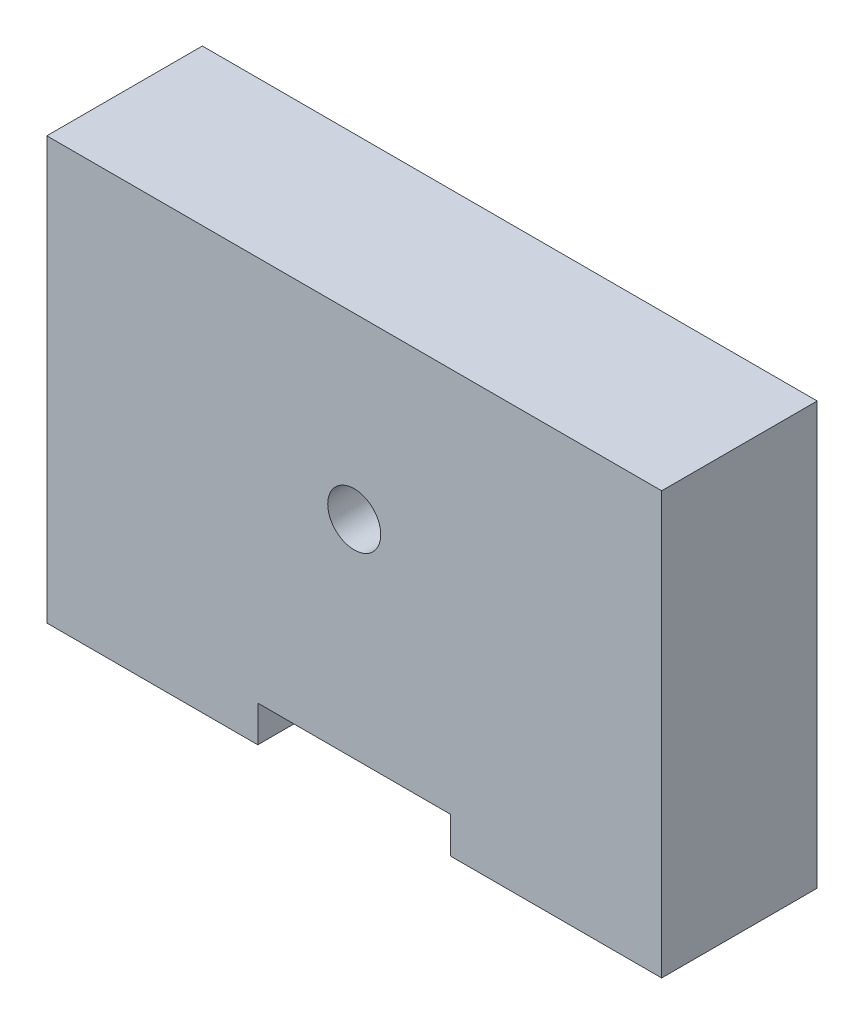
SolidWorks part; units mm, degrees
ref_plane "Front Plane" through (0, 0, 0) normal (0, 0, 1) x (1, 0, 0)
ref_plane "Top Plane" through (0, 0, 0) normal (0, 1, 0) x (1, 0, 0)
ref_plane "Right Plane" through (0, 0, 0) normal (1, 0, 0) x (0, 0, -1)
sketch "Sketch2" plane through (0, 0, 0) normal (0, 1, 0) x (1, 0, 0)
  line L0 (25.5, 6.45) -> (-25.5, 6.45)
  line L1 (25.5, 6.45) -> (25.5, -6.45)
  line L2 (25.5, -6.45) -> (-25.5, -6.45)
  line L3 (-25.5, 6.45) -> (-25.5, -6.45)
  line L4 (-18.75, 0) -> (18.75, 0) construction
  point P0 (-18.75, 0)
  point P1 (18.75, 0)
  point P6 (-25.5, 0)
  point P9 (0, 0)
  point P13 (0, 6.45)
  dimension "D1" = 37.5
  dimension "D2" = 12.9
  dimension "D3" = 51
extrude "Boss-Extrude1" add sketch "Sketch2" along normal blind 35
hole_wizard "M5x0.8 Tapped Hole1" positions "Sketch3" profile "Sketch4" tap size "M5x0.8" standard "ANSI Metric"
sketch "Sketch3" plane through (0, 0, 0) normal (0, -1, 0) x (-1, 0, 0)
  point P0 (-18.75, 0)
  point P3 (18.75, 0)
sketch "Sketch4" plane through (18.75, 0, 0) normal (1, 0, 0) x (0, 0, -1)
  line L0 (0, 0) -> (0, 13.6618)
  line L1 (0, 13.6618) -> (2.1, 12.4)
  line L2 (2.1, 12.4) -> (2.1, 0)
  line L5 (2.1, 0) -> (0, 0)
  line L10 (0, 13.6618) -> (-2.1, 12.4) construction
  line L11 (0, -6.35) -> (0, 107.95) construction
  dimension "Tap Drill Dia." = 4.2
  dimension "Tap Drill Depth" = 12.4
  dimension "Drill Angle" = 118
sketch "Sketch5" plane through (0, 0, -6.45) normal (0, 0, -1) x (-1, 0, 0)
  line L0 (-25.5, 0) -> (25.5, 0) construction
  line L1 (-8, 0) -> (8, 0)
  line L2 (-8, 0) -> (-8, 3)
  line L3 (-8, 3) -> (8, 3)
  line L4 (8, 0) -> (8, 3)
  circle A0 centre (0, 20.2) radius 2.2
  point P6 (0, 0)
  point P10 (0, 0)
  dimension "D3" = 4.4
  dimension "D1" = 3
  dimension "D2" = 16
  dimension "D4" = 20.2
extrude "Cut-Extrude1" cut sketch "Sketch5" against normal up to surface (12.9 mm away)
